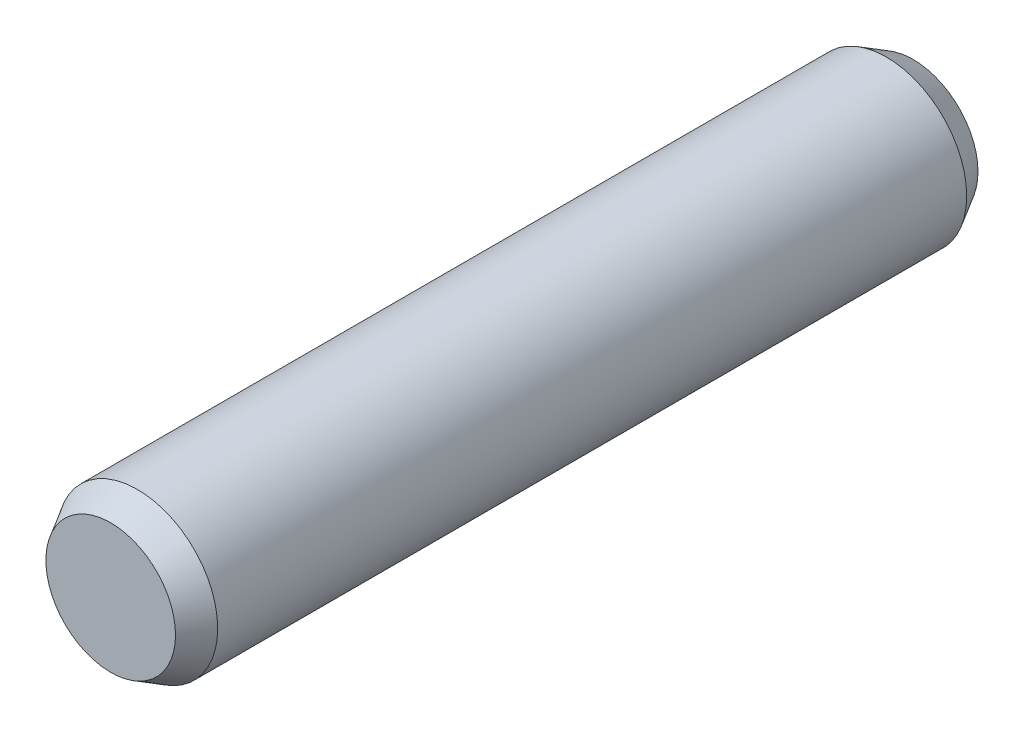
SolidWorks part; units mm, degrees
ref_plane "Face" through (0, 0, 0) normal (0, 0, 1) x (1, 0, 0)
ref_plane "Dessus" through (0, 0, 0) normal (0, 1, 0) x (1, 0, 0)
ref_plane "Profil" through (0, 0, 0) normal (1, 0, 0) x (0, 0, -1)
sketch "Esquisse1" plane through (0, 0, 0) normal (0, 0, 1) x (1, 0, 0)
  circle A0 centre (0, 0) radius 3
  dimension "D1" = 6
extrude "Base-Extrusion" add sketch "Esquisse1" along normal mid plane 30
chamfer "Chanfrein1" distance 1 angle 30
